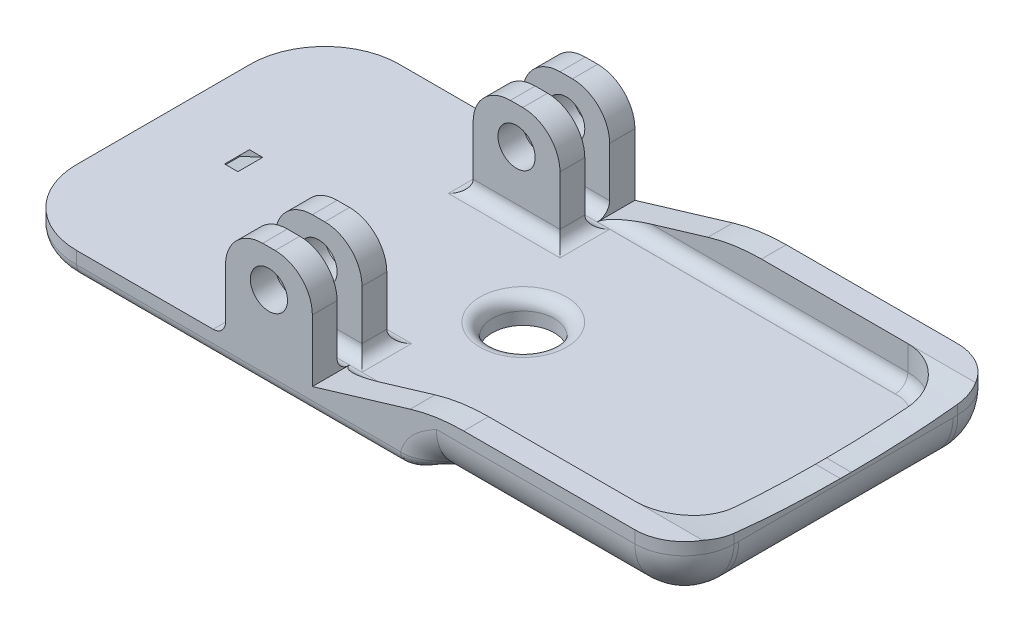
SolidWorks part; units mm, degrees
ref_plane "Front Plane" through (0, 0, 0) normal (0, 0, 1) x (1, 0, 0)
ref_plane "Top Plane" through (0, 0, 0) normal (0, 1, 0) x (1, 0, 0)
ref_plane "Right Plane" through (0, 0, 0) normal (1, 0, 0) x (0, 0, -1)
sketch "Sketch1" plane through (0, 0, 0) normal (0, 1, 0) x (1, 0, 0)
  line L1 (-27.5, 13) -> (27.5, 13)
  line L2 (-27.5, 13) -> (-27.5, -13)
  line L3 (-27.5, -13) -> (27.5, -13)
  line L4 (27.5, 13) -> (27.5, -13)
  line L5 (-27.5, 13) -> (27.5, -13) construction
  line L6 (-27.5, -13) -> (27.5, 13) construction
  point P0 (0, 0)
  dimension "D1" = 55
  dimension "D2" = 26
extrude "Boss-Extrude1" add sketch "Sketch1" along normal blind 5
sketch "Sketch2" plane through (0, 0, 0) normal (0, 0, 1) x (1, 0, 0)
  line L0 (-27.5, 2) -> (-2.5, 2)
  line L1 (-27.5, 5) -> (-27.5, 0) construction
  line L2 (-2.5, 2) -> (7.5, 5)
  line L3 (-27.5, 5) -> (27.5, 5) construction
  line L4 (7.5, 5) -> (-27.5, 5)
  line L5 (-27.5, 5) -> (-27.5, 2)
  dimension "D1" = 3
  dimension "D2" = 25
  dimension "D3" = 35
extrude "Cut-Extrude2" cut sketch "Sketch2" against normal through all both and the other way through all
shell "Shell2" thickness 2
sketch "Sketch7" plane through (0, 2, 0) normal (0, 1, 0) x (1, 0, 0)
  line L1 (-2.5, 13) -> (-9.5, 13)
  line L2 (-2.5, 13) -> (-2.5, 10.9595)
  line L3 (-2.5, 10.9595) -> (-9.5, 10.9595)
  line L4 (-9.5, 13) -> (-9.5, 10.9595)
  line L17 (-2.5, -9) -> (-9.5, -9)
  line L18 (-2.5, -9) -> (-2.5, -7)
  line L19 (-2.5, -7) -> (-9.5, -7)
  line L20 (-9.5, -9) -> (-9.5, -7)
  line L21 (-2.5, 8.9595) -> (-9.5, 8.9595)
  line L22 (-2.5, 8.9595) -> (-2.5, 6.9595)
  line L23 (-2.5, 6.9595) -> (-9.5, 6.9595)
  line L24 (-9.5, 8.9595) -> (-9.5, 6.9595)
  line L25 (-2.5, -13) -> (-9.5, -13)
  line L26 (-2.5, -13) -> (-2.5, -11.01)
  line L27 (-2.5, -11.01) -> (-9.5, -11.01)
  line L28 (-9.5, -13) -> (-9.5, -11.01)
  dimension "D1" = 7
  dimension "D2" = 7
  dimension "D3" = 7
  dimension "D4" = 7
  dimension "D5" = 2
  dimension "D6" = 2
  dimension "D7" = 1.99
  dimension "D9" = 2
extrude "Boss-Extrude2" add sketch "Sketch7" along normal blind 8
sketch "Sketch8" plane through (0, 2, 0) normal (0, 1, 0) x (1, 0, 0)
  line L0 (25.5, -11) -> (25.5, 11) construction
  circle A0 centre (1.5, 0) radius 2.5
  dimension "D1" = 5
  dimension "D2" = 24
extrude "Cut-Extrude3" cut sketch "Sketch8" against normal up to next
sketch "Sketch11" plane through (0, 5, 0) normal (0, 1, 0) x (1, 0, 0)
  line L0 (27.5, -13) -> (27.5, 13) construction
  line L1 (25.5, 11) -> (27.5, 11)
  line L2 (25.5, 11) -> (25.5, -11)
  line L3 (25.5, -11) -> (27.5, -11)
  line L4 (27.5, 11) -> (27.5, -11)
  dimension "D1" = 22
extrude "Cut-Extrude5" cut sketch "Sketch11" against normal blind 0.7
fillet "Fillet1" radius 80 2 edges at (26.5, 4.3, 11) (26.5, 4.3, -11)
sketch "Sketch12" plane through (0, 0, 13) normal (0, 0, 1) x (1, 0, 0)
  line L0 (-9.5, 10) -> (-9.5, 2) construction
  line L1 (-9.5, 10) -> (-2.5, 10) construction
  circle A0 centre (-6, 7) radius 1.5
  dimension "D1" = 3
  dimension "D2" = 3.5
  dimension "D3" = 3
extrude "Cut-Extrude6" cut sketch "Sketch12" against normal through all
fillet "Fillet2" radius 3 8 edges at (-9.5, 10, 12.005) (-9.5, 10, 8) (-2.5, 10, 8) (-9.5, 10, -7.9595) (-2.5, 10, -7.9595) (-2.5, 10, -11.9798) (-9.5, 10, -11.9798) (-2.5, 10, 12.005)
sketch "Sketch13" plane through (27.5, 0, 0) normal (1, 0, 0) x (0, 0, -1)
  line L0 (-13, 0) -> (-12, 0)
  line L1 (-13, 0) -> (13, 0) construction
  line L2 (-12, 0) -> (-13, 1)
  line L3 (-13, 5) -> (-13, 0) construction
  line L4 (-13, 1) -> (-13, 0)
  line L5 (0, 0) -> (0, 6.9854) construction
  line L6 (13, 0) -> (12, 0)
  line L7 (13, 1) -> (13, 0)
  line L8 (12, 0) -> (13, 1)
  dimension "D1" = 1
  dimension "D2" = 1
extrude "Cut-Extrude7" cut sketch "Sketch13" against normal blind 20
fillet "Fillet3" radius 4 4 edges at (25.5, 3.5, 11) (25.5, 3.5, -11) (27.5, 3, -13) (27.5, 3, 13)
fillet "Fillet5" radius 10 2 edges at (16.8229, 0, 12) (16.8229, 0, -12)
fillet "Fillet4" radius 6 2 edges at (-27.5, 1, 13) (-27.5, 1, -13)
fillet "Fillet6" radius 4 7 edges at (27.5, 0.0016, 8.8206) (27.5, 0.0016, -8.8206) (15.5, 1, 13) (25.8548, 0.6675, 12.2334) (27.5, 0, 0) (26.7002, 0.388, -11.3998) (15.5, 1, -13)
fillet "Fillet7" radius 1 5 edges at (9.5, 2, 11) (24.3284, 2, 9.8284) (25.5, 2, 0) (24.3284, 2, -9.8284) (9.5, 2, -11)
fillet "Fillet8" radius 15 2 edges at (7.5, 5, -12) (7.5, 5, 12)
fillet "Fillet9" radius 1 5 edges at (-7, 0, -13) (-25.7426, 0, -11.2426) (-27.5, 0, 0) (-25.7426, 0, 11.2426) (-7, 0, 13)
fillet "Fillet10" radius 3 4 edges at (7.5, 2.5054, -13) (7.5, 0, 10.3206) (7.5, 0, -10.3206) (7.5, 2.5054, 13)
fillet "Fillet11" radius 1 12 edges at (9.5, 2, -10) (-9.5, 2, -11.9798) (-6, 2, -10.9595) (-6, 2, 7) (-9.5, 2, 8) (-6, 2, 9) (-6, 2, 11.01) (-9.5, 2, 12.005) (-6, 2, -8.9595) (-9.5, 2, -7.9595) (-6, 2, -6.9595) (1.5, 2, 2.5)
sketch "Sketch14" plane through (0, 0, 0) normal (0, 0, 1) x (1, 0, 0)
  line L0 (-21.5743, 2) -> (-22.5028, 1.6287)
  line L1 (-21.5, 2) -> (-10.5, 2) construction
  line L2 (-22.5028, 1.6287) -> (-22.3171, 1.1644)
  line L3 (-22.3171, 1.1644) -> (-20.5, 2)
  line L4 (-20.5, 2) -> (-21.5743, 2)
  dimension "D1" = 1
  dimension "D2" = 0.5
  dimension "D3" = 2
  dimension "D4" = 10
extrude "Cut-Extrude8" cut sketch "Sketch14" against normal mid plane 2
